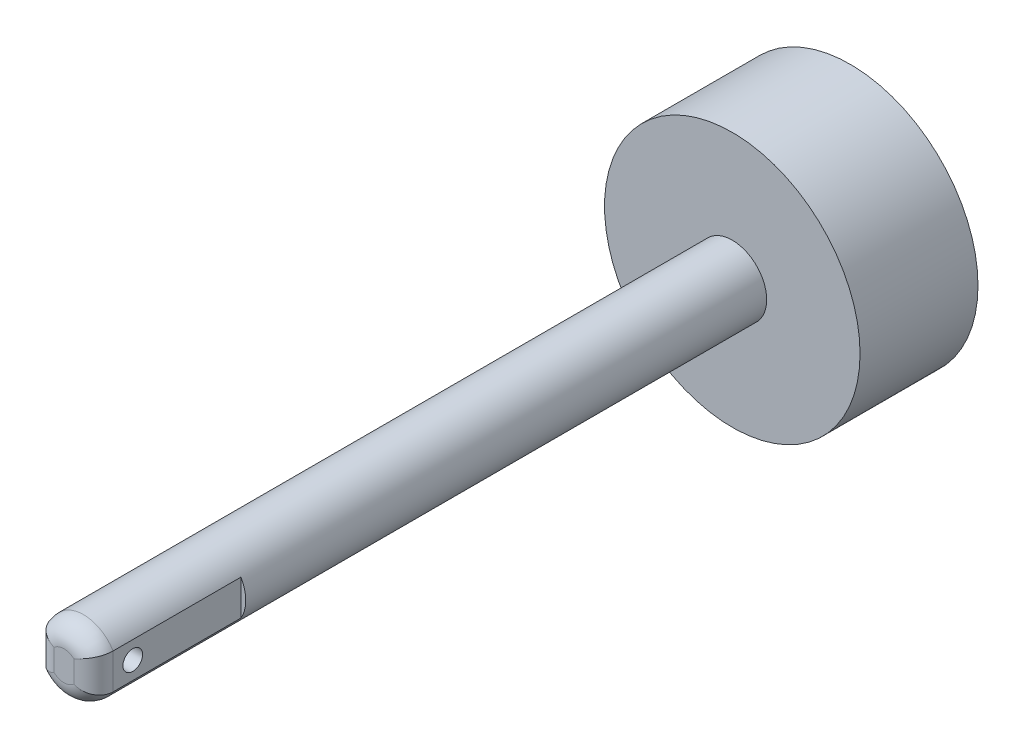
SolidWorks part; units mm, degrees
ref_plane "Frontal" through (0, 0, 0) normal (0, 0, 1) x (1, 0, 0)
ref_plane "Horizontal" through (0, 0, 0) normal (0, 1, 0) x (1, 0, 0)
ref_plane "Vertical" through (0, 0, 0) normal (1, 0, 0) x (0, 0, -1)
sketch "Esquisse1" plane through (0, 0, 0) normal (0, 0, 1) x (1, 0, 0)
  circle A0 centre (0, 0) radius 13
  dimension "D1" = 26
extrude "Base-Extrusion" add sketch "Esquisse1" along normal blind 12
sketch "Esquisse2" plane through (0, 0, 12) normal (0, 0, 1) x (1, 0, 0)
  circle A0 centre (0, 0) radius 3.5
  dimension "D1" = 7
extrude "Boss.-Extru.1" add sketch "Esquisse2" along normal blind 68
sketch "Esquisse3" plane through (0, 0, 80) normal (0, 0, 1) x (1, 0, 0)
  line L0 (0, -15.0004) -> (0, 15.7697) construction
  line L1 (-3, -3.8463) -> (-7.2309, -3.8463)
  line L2 (3, 4.077) -> (7.2309, 4.077)
  line L3 (3, 4.077) -> (3, -3.8463)
  line L4 (3, -3.8463) -> (7.2309, -3.8463)
  line L5 (7.2309, 4.077) -> (7.2309, -3.8463)
  line L6 (-7.2309, 4.077) -> (-7.2309, -3.8463)
  line L7 (-3, 4.077) -> (-7.2309, 4.077)
  line L8 (-3, 4.077) -> (-3, -3.8463)
  dimension "D1" = 6
extrude "Enlèv. mat.-Extru.1" cut sketch "Esquisse3" against normal blind 15
sketch "Esquisse4" plane through (3, 0, 0) normal (1, 0, 0) x (0, 0, -1)
  line L0 (-12, 0) -> (0, 0) construction
  line L1 (-12, 13) -> (-12, -13) construction
  circle A0 centre (-76, 0) radius 1
  dimension "D1" = 2
  dimension "D2" = 64
extrude "Enlèv. mat.-Extru.2" cut sketch "Esquisse4" against normal through all
fillet "Congé1" radius 2
